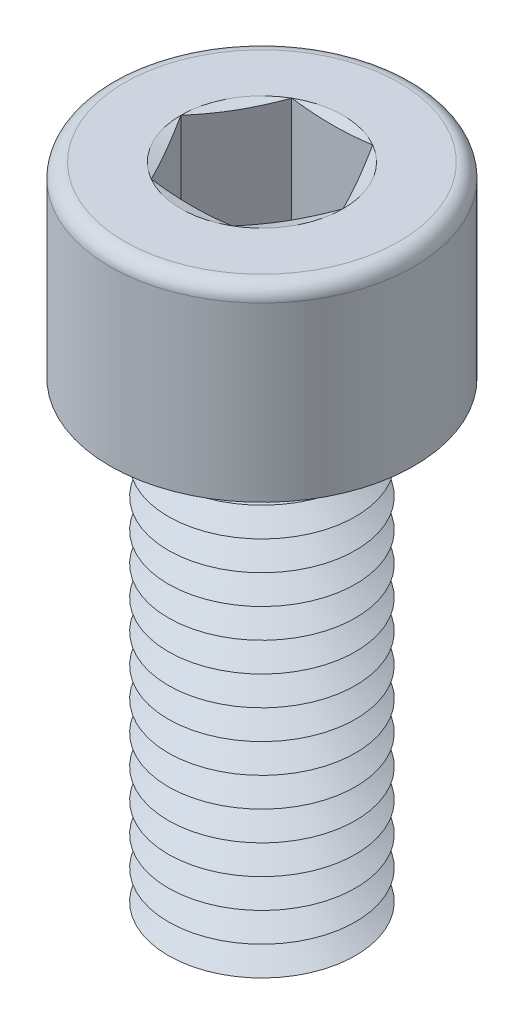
SolidWorks part; units mm, degrees
ref_plane "Front Plane" through (0, 0, 0) normal (0, 0, 1) x (1, 0, 0)
ref_plane "Top Plane" through (0, 0, 0) normal (0, 1, 0) x (1, 0, 0)
ref_plane "Right Plane" through (0, 0, 0) normal (1, 0, 0) x (0, 0, -1)
sketch "Sketch1" plane through (0, 0, 0) normal (0, 1, 0) x (1, 0, 0)
  circle A0 centre (0, 0) radius 4
  dimension "D1" = 8
extrude "Extrude1" add sketch "Sketch1" along normal blind 20
sketch "Sketch2" plane through (0, 20, 0) normal (0, 1, 0) x (1, 0, 0)
  circle A0 centre (0, 0) radius 6.5
  dimension "D1" = 13
extrude "Extrude2" add sketch "Sketch2" along normal blind 8
sketch "Sketch3" plane through (0, 28, 0) normal (0, 1, 0) x (1, 0, 0)
  line L1 (1.7321, 3) -> (-1.7321, 3)
  line L2 (-1.7321, 3) -> (-3.4641, 0)
  line L3 (-3.4641, 0) -> (-1.7321, -3)
  line L4 (-1.7321, -3) -> (1.7321, -3)
  line L5 (1.7321, -3) -> (3.4641, 0)
  line L6 (3.4641, 0) -> (1.7321, 3)
  circle A0 centre (0, 0) radius 3 construction
  dimension "D1" = 6
extrude "Extrude3" cut sketch "Sketch3" against normal blind 6
fillet "Fillet1" radius 0.625 1 edges at (0, 28, 6.5)
sketch "Sketch4" plane through (0, 0, 0) normal (1, 0, 0) x (0, 0, -1)
  line L0 (-3, 22) -> (0, 22)
  line L1 (0, 22) -> (0, 20.2679)
  line L2 (0, 20.2679) -> (-3, 22)
  dimension "D1" = 30
revolve "Cut-Revolve1" cut sketch "Sketch4" angle 360 about L1
sketch "Sketch5" plane through (0, 0, 0) normal (0, 0, 1) x (1, 0, 0)
  line L0 (-4, 0.625) -> (-4, -0.625)
  line L1 (-4, 20) -> (-4, 0) construction
  line L2 (-4, -0.625) -> (-2.9175, 0)
  line L3 (-4, 0) -> (4, 0) construction
  line L4 (-2.9175, 0) -> (-4, 0.625)
  dimension "D1" = 1.25
revolve "Cut-Revolve2" cut sketch "Sketch5" angle 360 about axis through (0, 20, 0) along (0, -1, 0)
pattern_linear "LPattern1" count 16 spacing 1.25 along (0, 1, 0) of "Cut-Revolve2"
sketch "Sketch6" plane through (0, 28, 0) normal (0, 1, 0) x (1, 0, 0)
  circle A0 centre (0, 0) radius 3.4641
extrude "Extrude4" cut sketch "Sketch6" against normal through all draft 75
